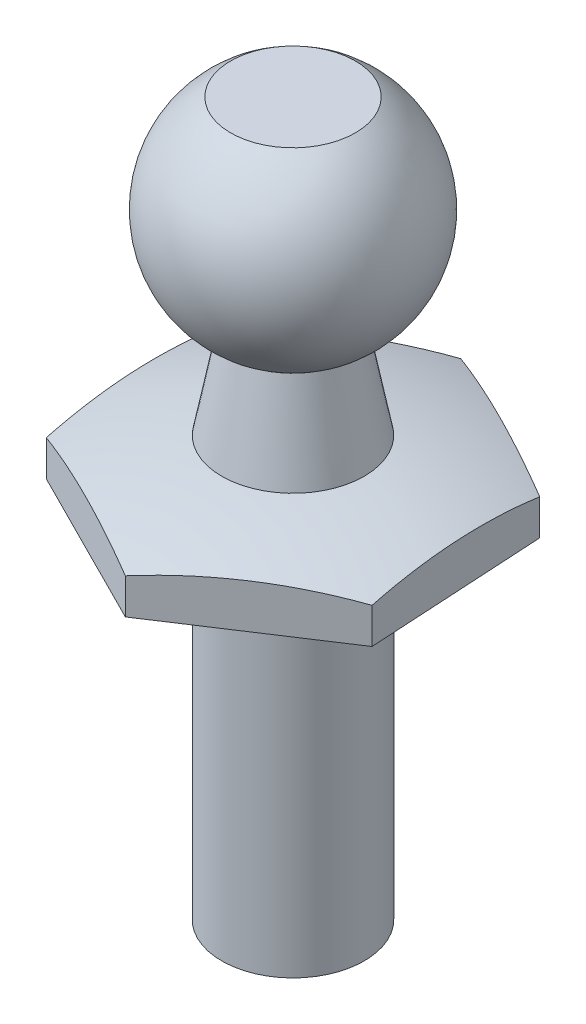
SolidWorks part; units mm, degrees
ref_plane "Face" through (0, 0, 0) normal (0, 0, 1) x (1, 0, 0)
ref_plane "Dessus" through (0, 0, 0) normal (0, 1, 0) x (1, 0, 0)
ref_plane "Droite" through (0, 0, 0) normal (1, 0, 0) x (0, 0, -1)
sketch "Esquisse1" plane through (0, 0, 0) normal (0, 0, 1) x (1, 0, 0)
  line L0 (0, 14.5228) -> (0, -48.5228) construction
  line L1 (0, -20) -> (4, -20)
  line L2 (10, 0) -> (10, 2)
  line L3 (4, -20) -> (4, 0)
  line L4 (3, 8.7565) -> (4, 3.5594)
  line L5 (0, -20) -> (0, 20)
  line L6 (0, 20) -> (3.5, 20)
  line L7 (4, 0) -> (10, 0)
  arc A0 (3, 8.7565) -> (3.5, 20) centre (0, 14.5228) ccw
  arc A1 (10, 2) -> (4, 3.5594) centre (0, -24.1534) ccw
  dimension "D6" = 6.5
  dimension "D2" = 28
  dimension "D1" = 40
  dimension "D3" = 3
  dimension "D4" = 2
  dimension "D5" = 4
  dimension "D7" = 3.5
  dimension "D8" = 10
  dimension "D9" = 4
  dimension "D10" = 20
revolve "Base-Révolution" add sketch "Esquisse1" angle 360 about L0
sketch "Esquisse4" plane through (0, -20, 0) normal (0, -1, 0) x (1, 0, 0)
  line L1 (8.9323, 4.4959) -> (0.5726, 9.9836)
  line L2 (0.5726, 9.9836) -> (-8.3598, 5.4877)
  line L3 (-8.3598, 5.4877) -> (-8.9323, -4.4959)
  line L4 (-8.9323, -4.4959) -> (-0.5726, -9.9836)
  line L5 (-0.5726, -9.9836) -> (8.3598, -5.4877)
  line L6 (8.3598, -5.4877) -> (8.9323, 4.4959)
  circle A0 centre (0, 0) radius 8.6603 construction
  circle A1 centre (0, 0) radius 10 construction
extrude "Enlèv. mat.-Extru.4" cut sketch "Esquisse4" against normal through all flip side to cut
